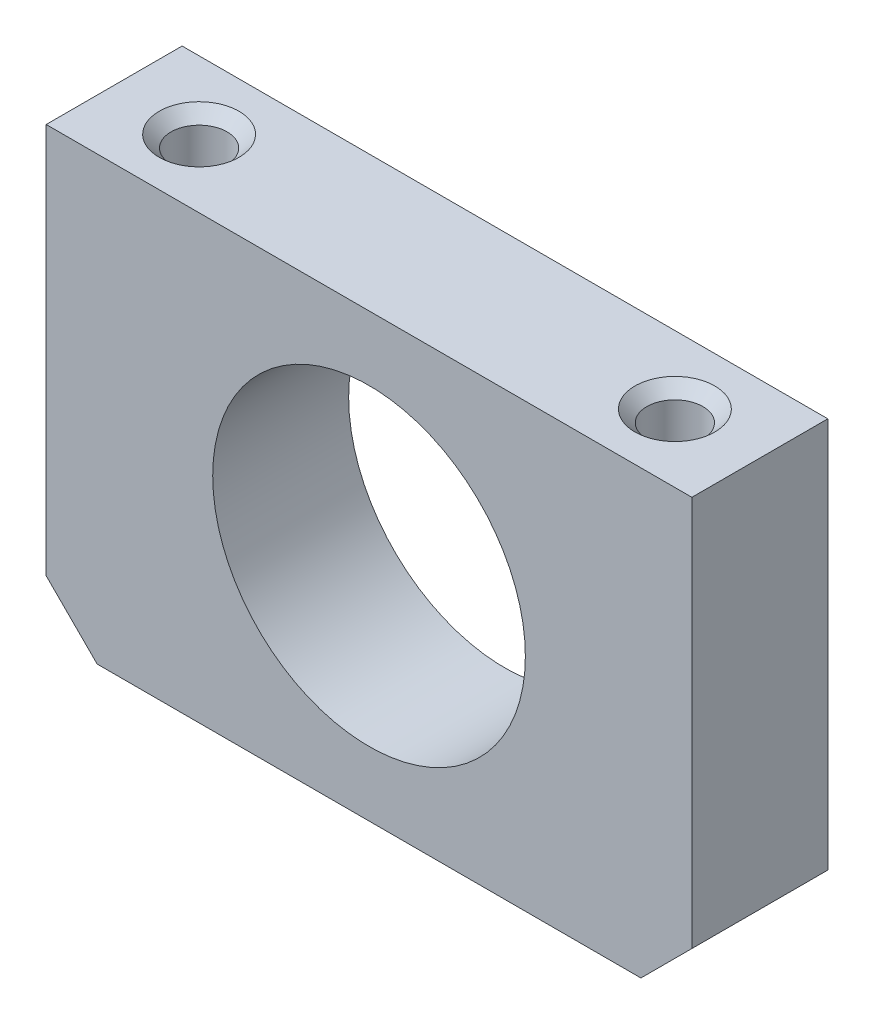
SolidWorks part; units mm, degrees
ref_plane "Спереди" through (0, 0, 0) normal (0, 0, 1) x (1, 0, 0)
ref_plane "Сверху" through (0, 0, 0) normal (0, 1, 0) x (1, 0, 0)
ref_plane "Справа" through (0, 0, 0) normal (1, 0, 0) x (0, 0, -1)
sketch "Эскиз1" plane through (0, 0, 0) normal (0, 0, 1) x (1, 0, 0)
  line L1 (0, 0) -> (38, 0)
  line L2 (0, 0) -> (0, 26)
  line L3 (0, 26) -> (38, 26)
  line L4 (38, 0) -> (38, 26)
  dimension "D1" = 26
  dimension "D2" = 38
extrude "Бобышка-Вытянуть1" add sketch "Эскиз1" along normal blind 8
sketch "Эскиз2" plane through (0, 0, 0) normal (0, 0, -1) x (-1, 0, 0)
  line L0 (-38, 26) -> (0, 26) construction
  line L1 (-19, 27.9902) -> (-19, -1.2456) construction
  circle A0 centre (-19, 13) radius 9.2
  point P6 (-19, 26)
  dimension "D1" = 18.4
  dimension "D2" = 13
extrude "Вырез-Вытянуть1" cut sketch "Эскиз2" against normal through all
chamfer "Фаска1" distance 3 angle 45 2 edges at (38, 0, 4) (0, 0, 4)
hole_wizard "Отверстие обработанное метчиком M41" positions "Эскиз3" profile "Эскиз4" tap size "M4" standard "ISO"
sketch "Эскиз3" plane through (0, 26, 0) normal (0, 1, 0) x (1, 0, 0)
  line L2 (19, 2.3292) -> (19, -10.486) construction
  line L4 (38, 0) -> (0, 0) construction
  line L6 (0, -8) -> (0, 0) construction
  point P0 (33, -4)
  point P2 (5, -4)
  point P15 (19, 0)
  point P21 (0, -4)
  dimension "D1" = 28
sketch "Эскиз4" plane through (33, 26, 4) normal (1, 0, 0) x (0, 0, 1)
  line L0 (0, 0) -> (0, 15.9914)
  line L1 (0, 15.9914) -> (1.65, 15)
  line L2 (1.65, 15) -> (1.65, 0)
  line L5 (1.65, 0) -> (0, 0)
  line L10 (0, 15.9914) -> (-1.65, 15) construction
  line L11 (0, -6.35) -> (0, 107.95) construction
  dimension "Диаметр сверла" = 3.3
  dimension "Глубина сверла" = 15
  dimension "Угол заточки сверла" = 118
chamfer "Фаска2" distance 0.7 angle 45 2 edges at (33, 26, 5.65) (5, 26, 5.65)
